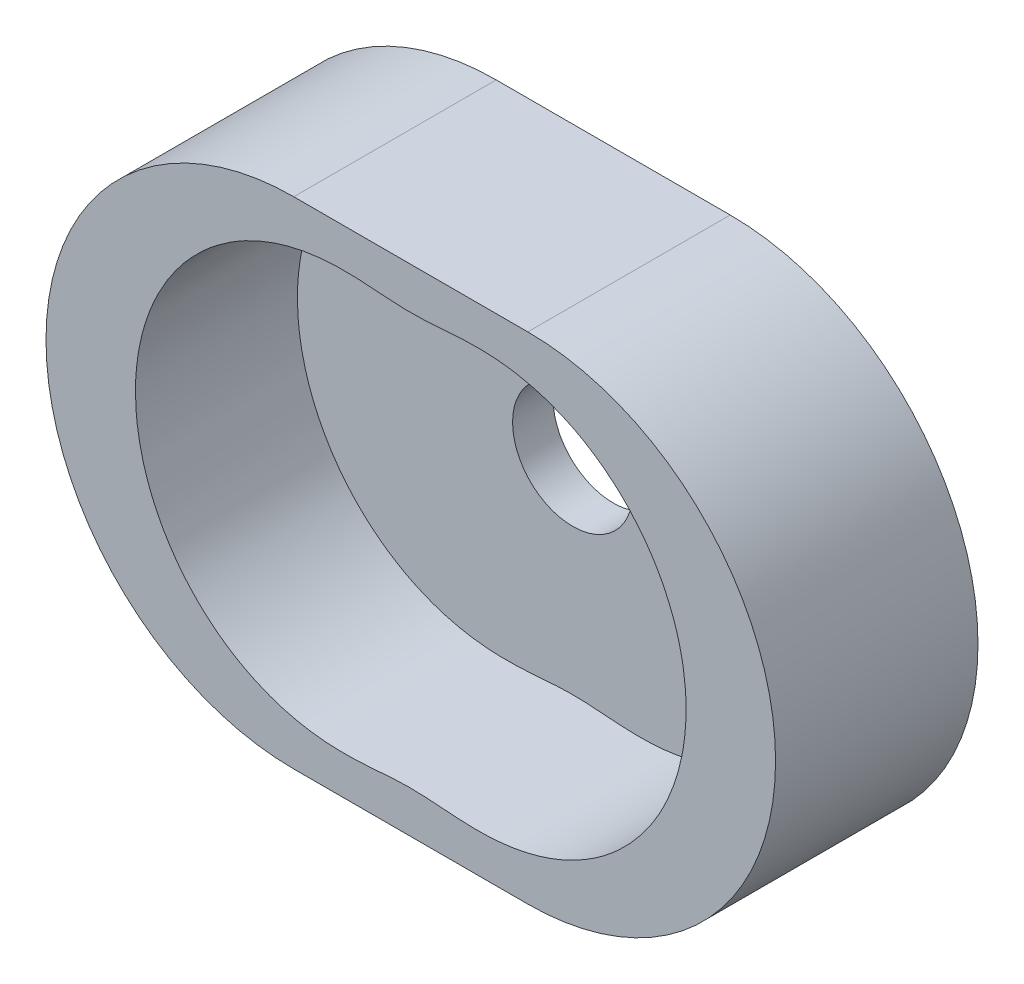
SolidWorks part; units mm, degrees
ref_plane "Front Plane" through (0, 0, 0) normal (0, 0, 1) x (1, 0, 0)
ref_plane "Top Plane" through (0, 0, 0) normal (0, 1, 0) x (1, 0, 0)
ref_plane "Right Plane" through (0, 0, 0) normal (1, 0, 0) x (0, 0, -1)
curve "Curve1"
sketch "Sketch2" plane through (0, 0, 0) normal (0, 0, 1) x (1, 0, 0)
  line L0 (-128.4605, 0) -> (128.4605, 0) construction
  line L1 (-128.4605, 272.034) -> (128.4605, 272.034)
  line L2 (-128.4605, -272.034) -> (128.4605, -272.034)
  arc A0 (-128.4605, 272.034) -> (-128.4605, -272.034) centre (-128.4605, 0) ccw
  arc A1 (128.4605, -272.034) -> (128.4605, 272.034) centre (128.4605, 0) ccw
  spline S0 degree 3 number of poles 6285 (302.26, 0.3785) -> (302.26, 0.3785) construction
  spline S1 degree 3 number of poles 6285 (302.26, 0.3785) -> (302.26, 0.3785)
  point P4 (0, 0)
extrude "Boss-Extrude1" add sketch "Sketch2" along normal blind 177.8
sketch "Sketch3" plane through (0, 0, 0) normal (0, 0, -1) x (-1, 0, 0)
  line L6 (128.4605, 272.034) -> (-128.4605, 272.034)
  line L7 (-128.4605, -272.034) -> (128.4605, -272.034)
  line L8 (128.4605, 272.034) -> (-128.4605, 272.034)
  line L9 (-128.4605, -272.034) -> (128.4605, -272.034)
  circle A4 centre (0, 0) radius 66.04
  arc A7 (128.4605, -272.034) -> (128.4605, 272.034) centre (128.4605, 0) ccw
  arc A8 (-128.4605, 272.034) -> (-128.4605, -272.034) centre (-128.4605, 0) ccw
  arc A9 (128.4605, -272.034) -> (128.4605, 272.034) centre (128.4605, 0) ccw
  arc A10 (-128.4605, 272.034) -> (-128.4605, -272.034) centre (-128.4605, 0) ccw
extrude "Boss-Extrude2" add sketch "Sketch3" along normal blind 44.45
equation "\"D1@Sketch2\" = \"HHS\" * 0.85"
equation "\"D2@Sketch2\" = \"HHS\" * 0.9"
equation "\"D1@Sketch3\"=\"R\"/2"
equation "\"D1@Boss-Extrude2\"=\"W\"*.25"
equation "\"D1@Boss-Extrude1\"=\"W\""
equation "\"E\"= 1.500000"
equation "\"R\"= 10.400000"
equation "\"RRS\"= 19.536364"
equation "\"HHS\"= 11.900000"
equation "\"W\"= 7.000000"
